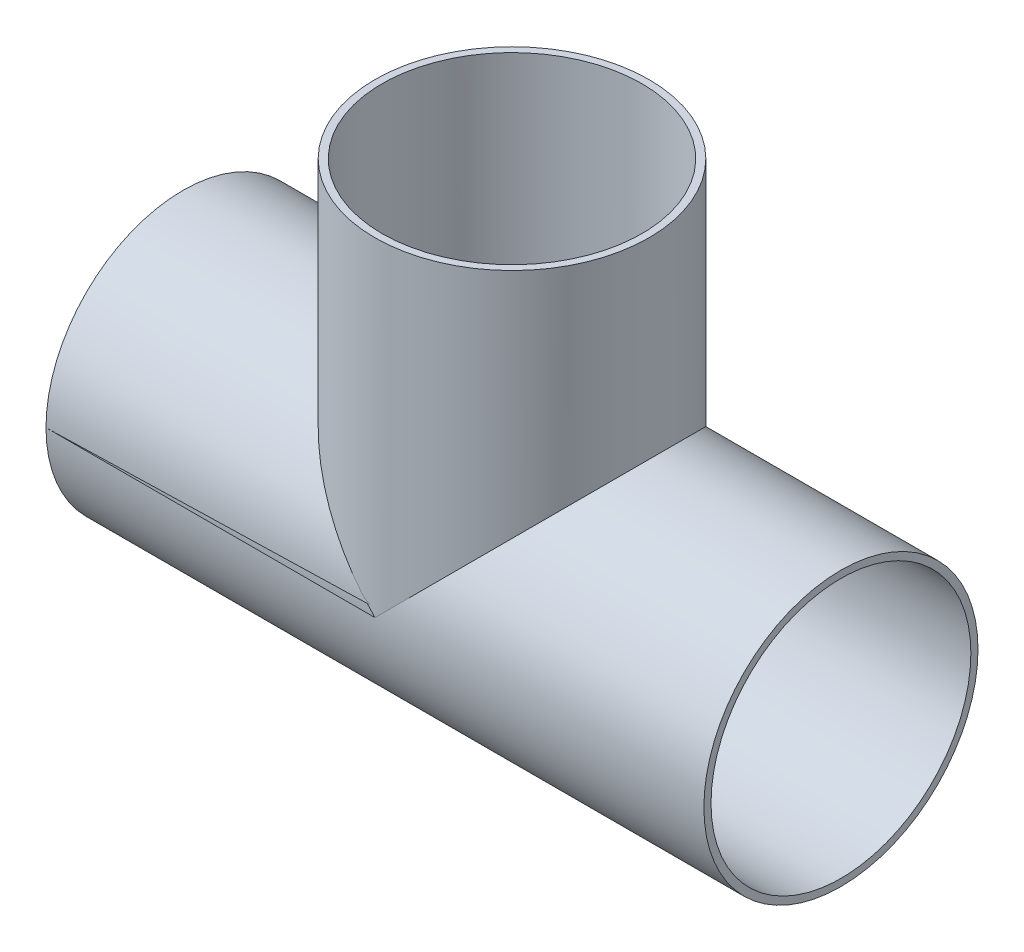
SolidWorks part; units mm, degrees
ref_plane "Front Plane" through (0, 0, 0) normal (0, 0, 1) x (1, 0, 0)
ref_plane "Top Plane" through (0, 0, 0) normal (0, 1, 0) x (1, 0, 0)
ref_plane "Right Plane" through (0, 0, 0) normal (1, 0, 0) x (0, 0, -1)
sketch "Sketch1" plane through (0, 0, 0) normal (0, 1, 0) x (1, 0, 0)
  circle A0 centre (0, 0) radius 31.75
extrude "Boss-Extrude1" add sketch "Sketch1" along normal blind 76.2
sketch "Sketch2" plane through (0, 0, 0) normal (1, 0, 0) x (0, 0, -1)
  circle A0 centre (0, 0) radius 31.75
extrude "Boss-Extrude2" add sketch "Sketch2" along normal mid plane 152.4
sketch "Sketch3" plane through (0, 76.2, 0) normal (0, 1, 0) x (1, 0, 0)
  circle A0 centre (0, 0) radius 30.099
extrude "Cut-Extrude1" cut sketch "Sketch3" against normal blind 76.2
sketch "Sketch4" plane through (76.2, 0, 0) normal (1, 0, 0) x (0, 0, -1)
  circle A0 centre (0, 0) radius 30.099
extrude "Cut-Extrude2" cut sketch "Sketch4" against normal through all
